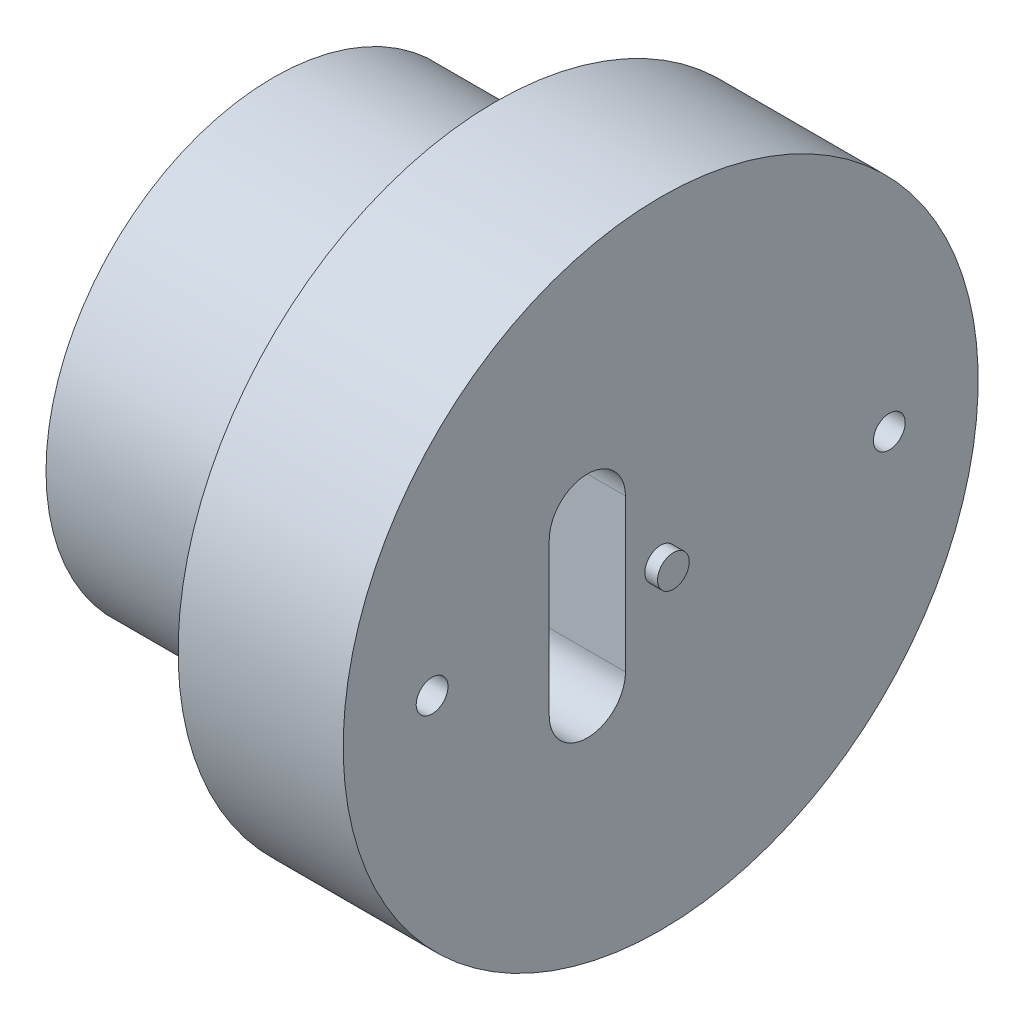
SolidWorks part; units mm, degrees
ref_plane "Front Plane" through (0, 0, 0) normal (0, 0, 1) x (1, 0, 0)
ref_plane "Top Plane" through (0, 0, 0) normal (0, 1, 0) x (1, 0, 0)
ref_plane "Right Plane" through (0, 0, 0) normal (1, 0, 0) x (0, 0, -1)
sketch "Sketch1" plane through (0, 0, 0) normal (0, 0, 1) x (1, 0, 0)
  line L0 (0, 0) -> (0, 35.8)
  line L1 (0, 35.8) -> (35, 35.8)
  line L2 (35, 35.8) -> (35, 50)
  line L3 (35, 50) -> (61, 50)
  line L4 (61, 50) -> (61, 2.5)
  line L5 (61, 2.5) -> (63, 2.5)
  line L6 (63, 2.5) -> (63, 0)
  line L7 (63, 0) -> (0, 0)
  dimension "D1" = 63
  dimension "D2" = 35
  dimension "D3" = 2
  dimension "D4" = 2.5
  dimension "D5" = 50
  dimension "D6" = 35.8
revolve "Revolve1" add sketch "Sketch1" angle 360 about L7
sketch "Sketch2" plane through (0, 0, 0) normal (-1, 0, 0) x (0, 0, 1)
  circle A0 centre (0, 0) radius 24
  dimension "D1" = 48
extrude "Extrude1" cut sketch "Sketch2" against normal blind 28
sketch "Sketch3" plane through (63, 0, 0) normal (1, 0, 0) x (0, 0, -1)
  line L0 (-48.8093, 0) -> (48.4092, 0) construction
  point P4 (-36, 0)
  point P5 (36, 0)
  dimension "D1" = 36
  dimension "D2" = 36
hole_wizard "M6 Tapped Hole1" positions "3DSketch1" profile "Sketch4" tap size "M6" standard "ISO"
sketch3d "3DSketch1"
  point P0 (63, 0, 36)
  point P3 (63, 0, -36)
sketch "Sketch4" plane through (63, 0, 36) normal (0, 1, 0) x (0, 0, -1)
  line L0 (0, 0) -> (0, 16.5022)
  line L1 (0, 16.5022) -> (2.5, 15)
  line L2 (2.5, 15) -> (2.5, 0)
  line L5 (2.5, 0) -> (0, 0)
  line L10 (0, 16.5022) -> (-2.5, 15) construction
  line L11 (0, -6.35) -> (0, 107.95) construction
  dimension "Tap Drill Dia." = 5
  dimension "Tap Drill Depth" = 15
  dimension "Drill Angle" = 118
sketch "Sketch5" plane through (61, 0, 0) normal (1, 0, 0) x (0, 0, -1)
  line L0 (-11.55, -12) -> (-11.55, 12) construction
  line L1 (-17.55, -12) -> (-17.55, 12)
  line L2 (-5.55, -12) -> (-5.55, 12)
  arc A0 (-17.55, -12) -> (-5.55, -12) centre (-11.55, -12) ccw
  arc A1 (-5.55, 12) -> (-17.55, 12) centre (-11.55, 12) ccw
  point P2 (-11.55, 0)
  dimension "D1" = 12
  dimension "D2" = 24
  dimension "D3" = 11.55
  dimension "D4" = 12
extrude "Extrude2" cut sketch "Sketch5" against normal through all
